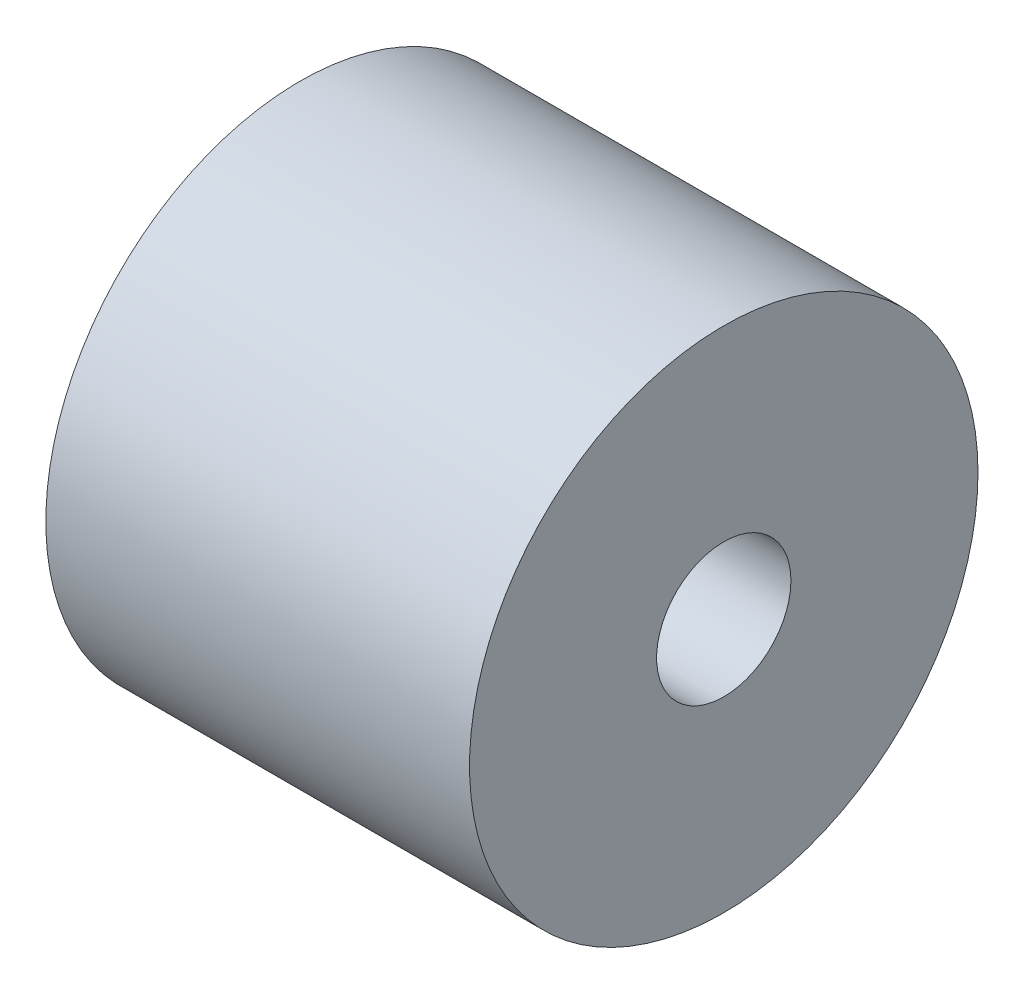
SolidWorks part; units mm, degrees
ref_plane "Plan de face" through (0, 0, 0) normal (0, 0, 1) x (1, 0, 0)
ref_plane "Plan de dessus" through (0, 0, 0) normal (0, 1, 0) x (1, 0, 0)
ref_plane "Plan de droite" through (0, 0, 0) normal (1, 0, 0) x (0, 0, -1)
sketch "Esquisse1" plane through (0, 0, 0) normal (1, 0, 0) x (0, 0, -1)
  circle A0 centre (0, 0) radius 6
  circle A1 centre (0, 0) radius 1.585
  dimension "D1" = 12
  dimension "D2" = 3.17
extrude "Boss.-Extru.1" add sketch "Esquisse1" along normal mid plane 10
